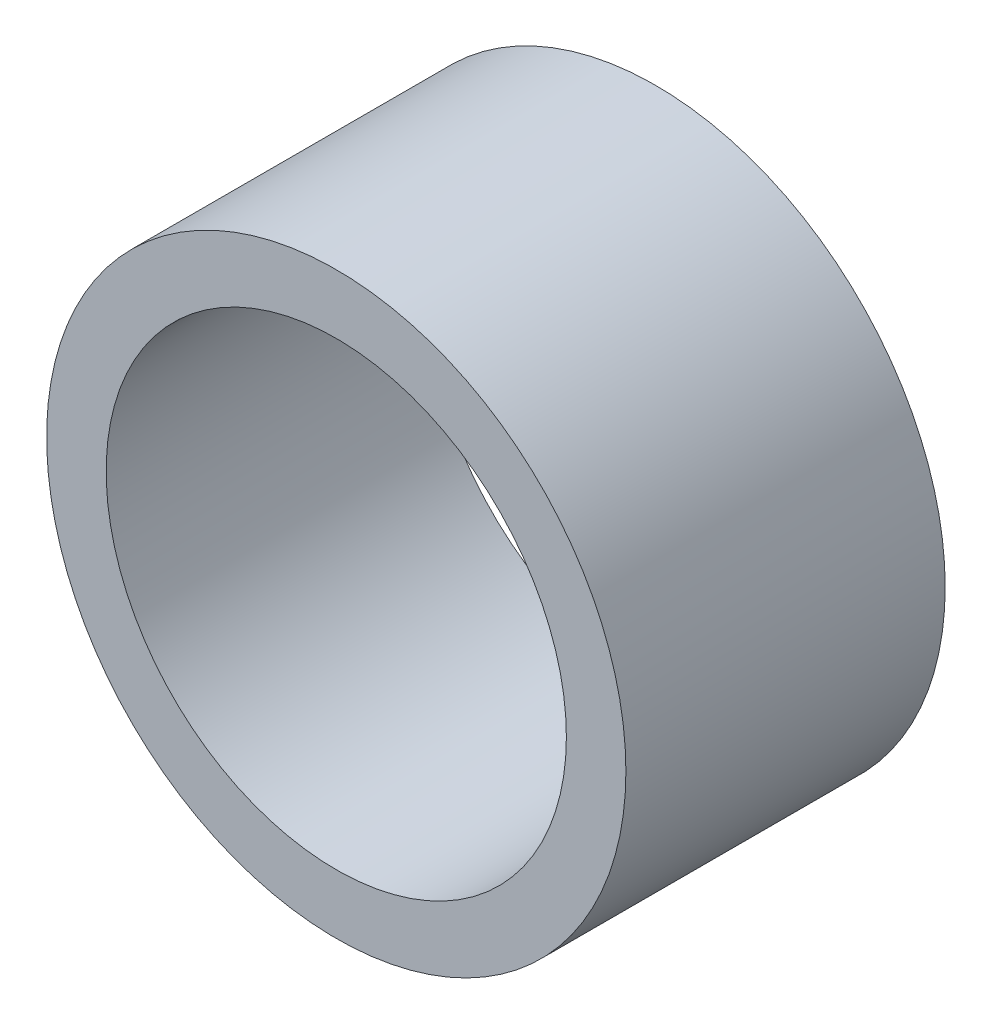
SolidWorks part; units mm, degrees
ref_plane "Front" through (0, 0, 0) normal (0, 0, 1) x (1, 0, 0)
ref_plane "Top" through (0, 0, 0) normal (0, 1, 0) x (1, 0, 0)
ref_plane "Right" through (0, 0, 0) normal (1, 0, 0) x (0, 0, -1)
sketch "Sketch1" plane through (0, 0, 0) normal (0, 0, 1) x (1, 0, 0)
  circle A0 centre (0, 0) radius 6.35
  circle A1 centre (0, 0) radius 5.045
  dimension "D1" = 10.09
  dimension "D2" = 12.7
extrude "Extrude1" add sketch "Sketch1" against normal blind 7
